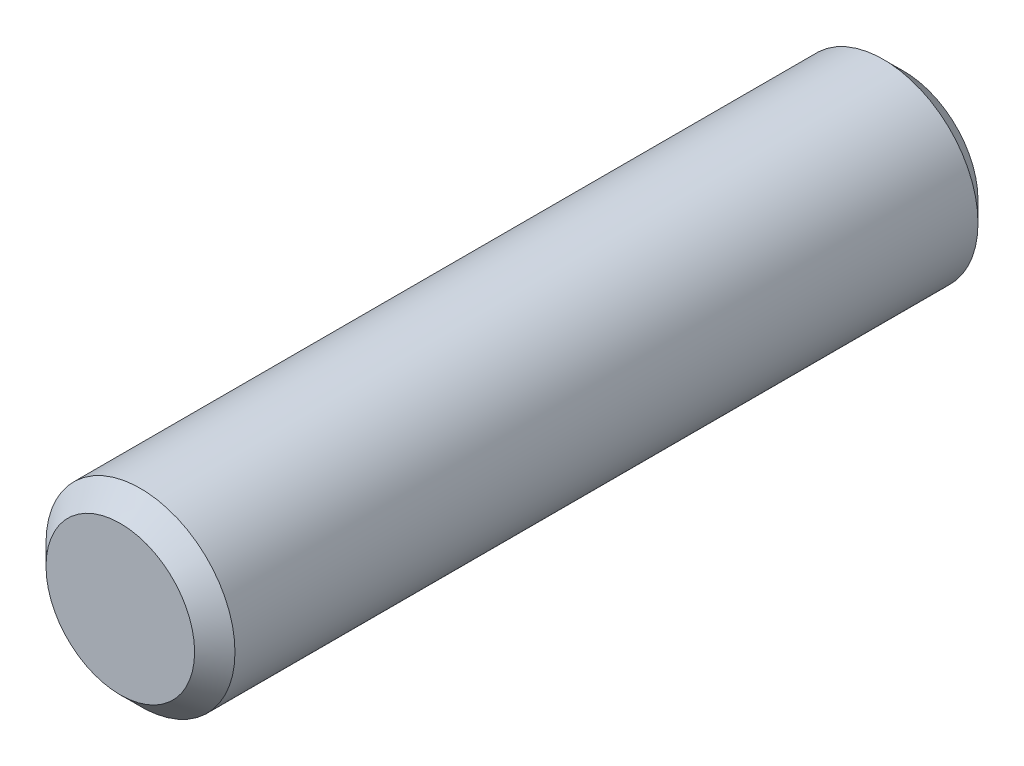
SolidWorks part; units mm, degrees
ref_plane "Front" through (0, 0, 0) normal (0, 0, 1) x (1, 0, 0)
ref_plane "Top" through (0, 0, 0) normal (0, 1, 0) x (1, 0, 0)
ref_plane "Right" through (0, 0, 0) normal (1, 0, 0) x (0, 0, -1)
sketch "Master Sketch" plane through (0, 0, 0) normal (0, 0, 1) x (1, 0, 0)
  circle A0 centre (0, 0) radius 2.9718
  circle A1 centre (0, 0) radius 4.464
  circle A2 centre (0, 0) radius 5.9563
sketch "Sketch2" plane through (0, 0, 0) normal (0, 0, 1) x (1, 0, 0)
  circle A2 centre (0, 0) radius 2.9718 construction
  circle A4 centre (0, 0) radius 2.9718
extrude "Base-Extrude" add sketch "Sketch2" along normal mid plane 24.638
chamfer "Chamfer1" distance 0.635 angle 45 2 edges at (2.9718, 0, -12.319) (2.9718, 0, 12.319)
equation "\"Bushing Diameter@Master Sketch\" = \"Pin Diameter@Master Sketch\" +  (  ( \"Roller Diameter@Master Sketch\" - \"Pin Diameter@Master Sketch\" )  / 2 ) "
